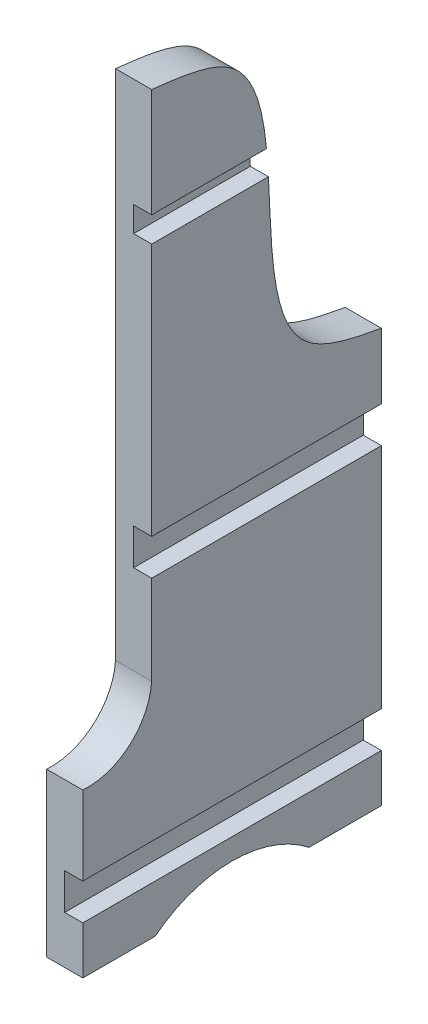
SolidWorks part; units mm, degrees
ref_plane "Front Plane" through (0, 0, 0) normal (0, 0, 1) x (1, 0, 0)
ref_plane "Top Plane" through (0, 0, 0) normal (0, 1, 0) x (1, 0, 0)
ref_plane "Right Plane" through (0, 0, 0) normal (1, 0, 0) x (0, 0, -1)
sketch "Sketch1" plane through (0, 0, 0) normal (1, 0, 0) x (0, 0, -1)
  line L0 (-51.941, 0) -> (-31.941, 0)
  line L1 (30.609, 0) -> (30.609, 114.3)
  line L2 (-51.941, 0) -> (-51.941, 45)
  line L3 (-32.891, 61.4979) -> (-32.891, 203.2)
  line L4 (30.609, 0) -> (10.609, 0)
  arc A0 (-32.891, 61.4979) -> (-51.941, 45) centre (-50.6649, 62.7739) cw
  arc A1 (-31.941, 0) -> (10.609, 0) centre (-10.666, -27.0078) cw
  spline S0 degree 3 poles (-32.891, 203.2) (-24.7894, 202.2844) (12.3984, 198.0814) (-12.7256, 122.3796) (23.1368, 115.6932) (30.609, 114.3) knots 0 0 0 0 0.180665 0.829285 1 1 1 1
  dimension "D1" = 82.55
  dimension "D2" = 45
  dimension "D3" = 203.2
  dimension "D4" = 63.5
  dimension "D5" = 20
  dimension "D6" = 20
extrude "Extrude1" add sketch "Sketch1" along normal blind 10
sketch "Sketch2" plane through (0, 0, 0) normal (1, 0, 0) x (0, 0, -1)
  line L1 (-33.405, 173.2) -> (-0.6224, 173.2)
  line L2 (-33.405, 173.2) -> (-33.405, 166.2)
  line L3 (-33.405, 166.2) -> (-0.6224, 166.2)
  line L4 (-0.6224, 173.2) -> (-0.6224, 166.2)
  spline S0 degree 3 poles (30.609, 114.3) (23.1368, 115.6932) (-12.7256, 122.3796) (12.3984, 198.0814) (-24.7894, 202.2844) (-32.891, 203.2) knots 0 0 0 0 0.170715 0.819335 1 1 1 1 construction
  dimension "D1" = 30
  dimension "D2" = 7
extrude "Cut-Extrude1" cut sketch "Sketch2" against normal blind 5 from offset 10
sketch "Sketch3" plane through (0, 0, 0) normal (1, 0, 0) x (0, 0, -1)
  line L0 (30.609, 0) -> (30.609, 114.3) construction
  line L1 (-33.0757, 96.2) -> (30.609, 96.2)
  line L2 (-33.0757, 96.2) -> (-33.0757, 86.2)
  line L3 (-33.0757, 86.2) -> (30.609, 86.2)
  line L4 (30.609, 96.2) -> (30.609, 86.2)
  dimension "D1" = 70
  dimension "D2" = 10
extrude "Cut-Extrude3" cut sketch "Sketch3" against normal blind 5 from offset 10
sketch "Sketch4" plane through (0, 0, 0) normal (1, 0, 0) x (0, 0, -1)
  line L1 (30.914, 23.2) -> (-52.3519, 23.2)
  line L2 (30.914, 23.2) -> (30.914, 13.2)
  line L3 (30.914, 13.2) -> (-52.3519, 13.2)
  line L4 (-52.3519, 23.2) -> (-52.3519, 13.2)
  dimension "D1" = 180
  dimension "D2" = 10
extrude "Cut-Extrude4" cut sketch "Sketch4" against normal blind 5 from offset 10
